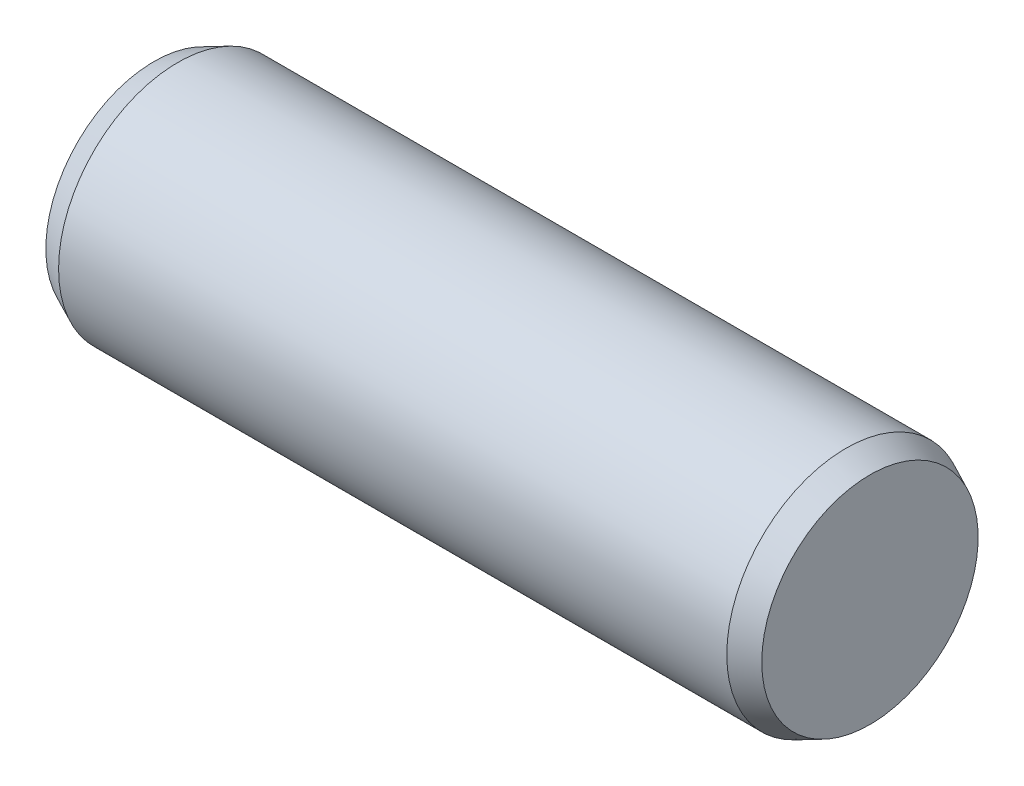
SolidWorks part; units mm, degrees
ref_plane "Спереди" through (0, 0, 0) normal (0, 0, 1) x (1, 0, 0)
ref_plane "Сверху" through (0, 0, 0) normal (0, 1, 0) x (1, 0, 0)
ref_plane "Справа" through (0, 0, 0) normal (1, 0, 0) x (0, 0, -1)
sketch "Эскиз1" plane through (0, 0, 0) normal (0, 0, 1) x (1, 0, 0)
  line L1 (0, 0) -> (30, 0)
  line L2 (0, 0) -> (0, 5)
  line L3 (0, 5) -> (30, 5)
  line L4 (30, 0) -> (30, 5)
  dimension "D1" = 5
  dimension "D2" = 30
revolve "Повернуть1" add sketch "Эскиз1" angle 360 about L1
chamfer "Фаска1" distance 1 angle 25 2 edges at (0, 0, 5) (30, 0, 5)
